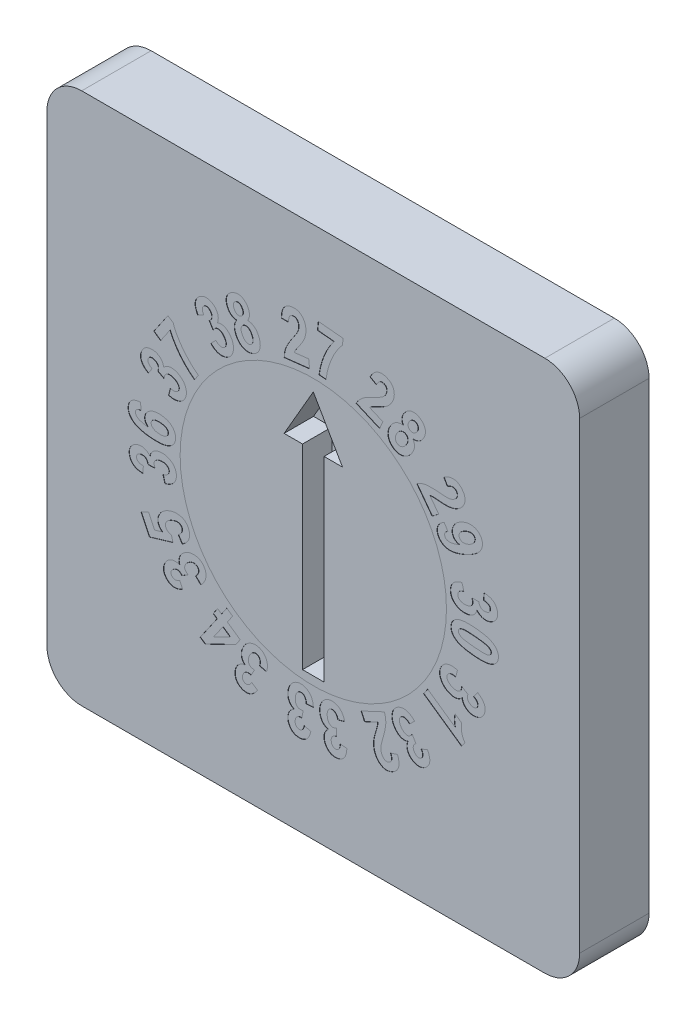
SolidWorks part; units mm, degrees
ref_plane "Front Plane" through (0, 0, 0) normal (0, 0, 1) x (1, 0, 0)
ref_plane "Top Plane" through (0, 0, 0) normal (0, 1, 0) x (1, 0, 0)
ref_plane "Right Plane" through (0, 0, 0) normal (1, 0, 0) x (0, 0, -1)
sketch "Sketch1" plane through (0, 0, 0) normal (0, 0, 1) x (1, 0, 0)
  line L1 (-20, 23) -> (20, 23)
  line L2 (-23, 20) -> (-23, -20)
  line L3 (-20, -23) -> (20, -23)
  line L4 (23, 20) -> (23, -20)
  line L5 (-23, 23) -> (23, -23) construction
  line L6 (-23, -23) -> (23, 23) construction
  arc A0 (20, 23) -> (23, 20) centre (20, 20) cw
  arc A1 (-23, -20) -> (-20, -23) centre (-20, -20) ccw
  arc A2 (-20, 23) -> (-23, 20) centre (-20, 20) ccw
  arc A3 (20, -23) -> (23, -20) centre (20, -20) ccw
  point P0 (0, 0)
  dimension "D1" = 3
  dimension "D2" = 46
  dimension "D3" = 46
extrude "Boss-Extrude1" add sketch "Sketch1" along normal blind 5.9944
sketch "Sketch13" plane through (0, 0, 5.9944) normal (0, 0, 1) x (1, 0, 0)
  circle A0 centre (0, 0) radius 11.5
  dimension "D1" = 23
extrude "Cut-Extrude3" cut sketch "Sketch13" against normal through all
sketch "Sketch14" plane through (0, 0, 5.9944) normal (0, 0, 1) x (1, 0, 0)
  line L0 (0, 0) -> (0, 18.9191) construction
  line L1 (0, 0) -> (10.2285, 15.9158) construction
  line L2 (0, 0) -> (17.2094, 7.8593) construction
  line L3 (0, 0) -> (18.7266, -2.6925) construction
  line L4 (0, 0) -> (14.2981, -12.3894) construction
  line L5 (0, 0) -> (5.3301, -18.1528) construction
  line L6 (0, 0) -> (-5.3301, -18.1528) construction
  line L7 (0, 0) -> (-14.2981, -12.3894) construction
  line L8 (0, 0) -> (-18.7266, -2.6925) construction
  line L9 (0, 0) -> (-17.2094, 7.8593) construction
  line L10 (0, 0) -> (-10.2285, 15.9158) construction
  arc A0 (-2.6231, 11.7808) -> (-3.109, 11.662) centre (0, 0) cw construction
  text T0 "27 28 29 30 31 32 33 34 35 36 37 38" font "Arial Narrow" height 4
  point P16 (0, 0)
  dimension "D1" = 11
extrude "YEARS" cut sketch "Sketch14" against normal blind 0.0254
sketch "Sketch18" plane through (0, 0, 0) normal (0, 0, -1) x (-1, 0, 0)
  line L0 (23, 2.709) -> (23, -2.709)
  line L1 (23, 20) -> (23, -20) construction
  arc A0 (23, 2.709) -> (23, -2.709) centre (26.683, 0) ccw
  dimension "D1" = 9.144
  dimension "D2" = 0.889
extrude "Cut-Extrude4" cut sketch "Sketch18" against normal blind 2.032
sketch "Sketch19" plane through (0, 0, 0) normal (0, 0, -1) x (-1, 0, 0)
  line L0 (0, 24.1164) -> (0, 0) construction
  line L1 (0, 0) -> (-27.8764, 0) construction
  circle A0 centre (-19.9898, 19.9898) radius 2
  circle A1 centre (19.9898, 19.9898) radius 2
  circle A2 centre (-19.9898, -19.9898) radius 2
  circle A3 centre (19.9898, -19.9898) radius 2
  dimension "D1" = 4
  dimension "D2" = 39.9796
  dimension "D3" = 39.9796
extrude "Cut-Extrude5" cut sketch "Sketch19" against normal blind 4
sketch "Sketch20" plane through (0, 0, 0) normal (0, 0, -1) x (-1, 0, 0)
  line L0 (0, 24.5295) -> (0, 0) construction
  line L1 (0, 0) -> (-31.7052, 0) construction
  line L2 (-22.111, -16.8468) -> (-22.111, 16.8468)
  line L3 (-16.8468, 22.111) -> (16.8468, 22.111)
  line L4 (-20, 23) -> (20, 23) construction
  line L5 (-23, -20) -> (-23, 20) construction
  line L6 (-22.111, 16.8468) -> (-19.9898, 16.8468)
  line L7 (-16.8468, 19.9898) -> (-16.8468, 22.111)
  line L8 (16.8468, 19.9898) -> (16.8468, 22.111)
  line L9 (22.111, 16.8468) -> (19.9898, 16.8468)
  line L10 (22.111, -16.8468) -> (22.111, -2.9865)
  line L11 (22.111, -16.8468) -> (19.9898, -16.8468)
  line L12 (16.8468, -19.9898) -> (16.8468, -22.111)
  line L13 (-16.8468, -22.111) -> (16.8468, -22.111)
  line L14 (-16.8468, -19.9898) -> (-16.8468, -22.111)
  line L15 (-22.111, -16.8468) -> (-19.9898, -16.8468)
  line L16 (22.111, 2.9865) -> (22.111, 16.8468)
  arc A0 (-19.9898, 16.8468) -> (-16.8468, 19.9898) centre (-19.9898, 19.9898) ccw
  circle A1 centre (-19.9898, 19.9898) radius 2 construction
  arc A2 (19.9898, 16.8468) -> (16.8468, 19.9898) centre (19.9898, 19.9898) cw
  arc A3 (19.9898, -16.8468) -> (16.8468, -19.9898) centre (19.9898, -19.9898) ccw
  arc A4 (-19.9898, -16.8468) -> (-16.8468, -19.9898) centre (-19.9898, -19.9898) cw
  arc A7 (22.2839, 3.2358) -> (22.2839, -3.2358) centre (26.683, 0) ccw
  arc A8 (22.111, 2.9865) -> (22.111, -2.9865) centre (26.683, 0) ccw
  point P23 (0, 22.111)
  point P32 (22.111, 0)
  point P35 (-22.111, 0)
  dimension "D3" = 1.143
  dimension "D1" = 0.889
  dimension "D2" = 0.889
  dimension "D4" = 0.889
extrude "Cut-Extrude6" cut sketch "Sketch20" against normal blind 0.8128
sketch "Sketch21" plane through (0, 0, 0) normal (0, 0, -1) x (-1, 0, 0)
  line L0 (-22.111, 16.8468) -> (-22.111, 20)
  line L1 (-20, 22.111) -> (-16.8468, 22.111)
  line L2 (-19.9898, 16.8468) -> (-22.111, 16.8468) construction
  line L3 (-16.8468, 22.111) -> (-16.8468, 19.9898) construction
  line L4 (-19.9898, 16.8468) -> (-22.111, 16.8468)
  line L5 (-16.8468, 22.111) -> (-16.8468, 19.9898)
  line L6 (0, 24.199) -> (0, 0) construction
  line L7 (0, 0) -> (-33.5508, 0) construction
  line L8 (16.8468, 22.111) -> (16.8468, 19.9898)
  line L9 (19.9898, 16.8468) -> (22.111, 16.8468)
  line L10 (20, 22.111) -> (16.8468, 22.111)
  line L11 (22.111, 16.8468) -> (22.111, 20)
  line L12 (22.111, -16.8468) -> (22.111, -20)
  line L13 (20, -22.111) -> (16.8468, -22.111)
  line L14 (19.9898, -16.8468) -> (22.111, -16.8468)
  line L15 (16.8468, -22.111) -> (16.8468, -19.9898)
  line L16 (-16.8468, -22.111) -> (-16.8468, -19.9898)
  line L17 (-19.9898, -16.8468) -> (-22.111, -16.8468)
  line L18 (-20, -22.111) -> (-16.8468, -22.111)
  line L19 (-22.111, -16.8468) -> (-22.111, -20)
  arc A0 (-19.9898, 16.8468) -> (-16.8468, 19.9898) centre (-19.9898, 19.9898) ccw construction
  arc A1 (-19.9898, 16.8468) -> (-16.8468, 19.9898) centre (-19.9898, 19.9898) ccw
  arc A2 (-22.111, 20) -> (-20, 22.111) centre (-20, 20) cw
  arc A4 (-20, 23) -> (-23, 20) centre (-20, 20) ccw construction
  arc A5 (22.111, 20) -> (20, 22.111) centre (20, 20) ccw
  arc A6 (19.9898, 16.8468) -> (16.8468, 19.9898) centre (19.9898, 19.9898) cw
  arc A7 (19.9898, -16.8468) -> (16.8468, -19.9898) centre (19.9898, -19.9898) ccw
  arc A8 (22.111, -20) -> (20, -22.111) centre (20, -20) cw
  arc A9 (-22.111, -20) -> (-20, -22.111) centre (-20, -20) ccw
  arc A10 (-19.9898, -16.8468) -> (-16.8468, -19.9898) centre (-19.9898, -19.9898) cw
  dimension "D1" = 0.889
extrude "Cut-Extrude7" cut sketch "Sketch21" against normal blind 0.8128
imported_body "Imported1"
move or copy body "Body-Move/Copy2" bodies to move or copy 121 placed by mates yes parameters "D1"=0, "D2"=0, "D3"=0
imported_body "Imported1_Ø4x4 NeoMagnet"
move or copy body "Body-Move/Copy5" bodies to move or copy 124 copy no translate (24.5186, 28.2695, 0.911) parameters "D1"=0, "D2"=0, "D3"=0
move or copy body "Body-Move/Copy4" bodies to move or copy 125 placed by mates yes parameters "D1"=0, "D2"=0, "D3"=0
pattern_circular "CirPattern1" count 4 over 360
imported_body "Imported1_Backing_Plate"
